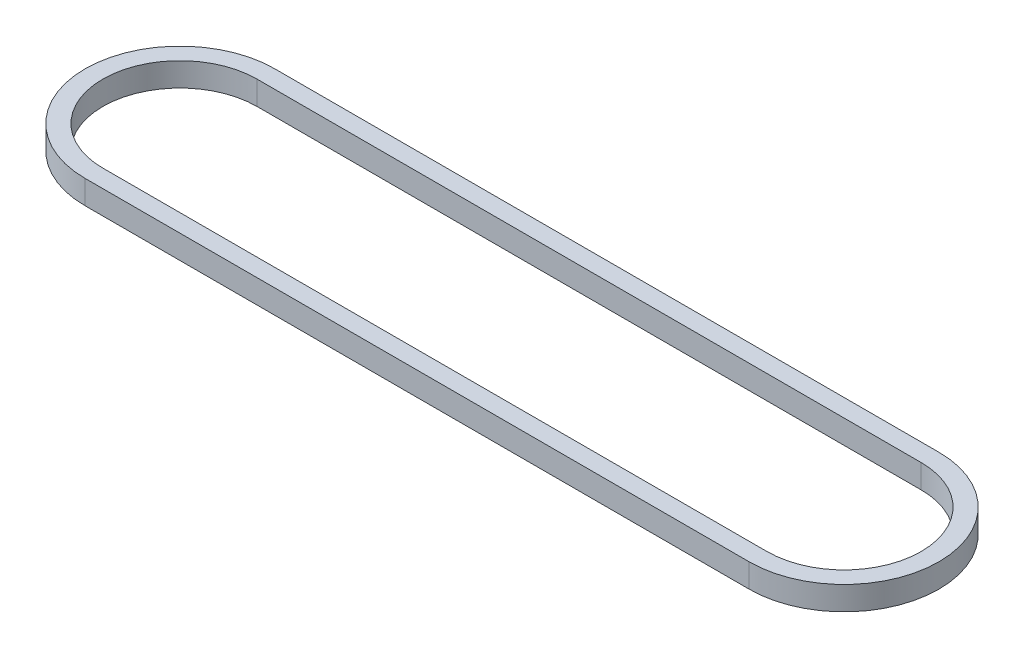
SolidWorks part; units mm, degrees
ref_plane "Front Plane" through (0, 0, 0) normal (0, 0, 1) x (1, 0, 0)
ref_plane "Top Plane" through (0, 0, 0) normal (0, 1, 0) x (1, 0, 0)
ref_plane "Right Plane" through (0, 0, 0) normal (1, 0, 0) x (0, 0, -1)
sketch "Sketch1" plane through (0, 0, 0) normal (0, 1, 0) x (1, 0, 0)
  line L0 (0, 0) -> (280, 0) construction
  line L1 (0, 32.5) -> (280, 32.5)
  line L2 (0, 40) -> (280, 40)
  line L3 (0, -40) -> (280, -40)
  line L5 (280, -32.5) -> (0, -32.5)
  circle A0 centre (0, 0) radius 32.5
  circle A1 centre (0, 0) radius 40
  circle A2 centre (280, 0) radius 32.5
  circle A3 centre (280, 0) radius 40
  dimension "D1" = 65
  dimension "D2" = 80
  dimension "D3" = 280
extrude "Boss-Extrude1" add sketch "Sketch1" along normal blind 10 contours A1 L5 A0 L1 | A3 L5 A1 L3 | A3 L2 A1 L1 | A3 L1 A2 L5
